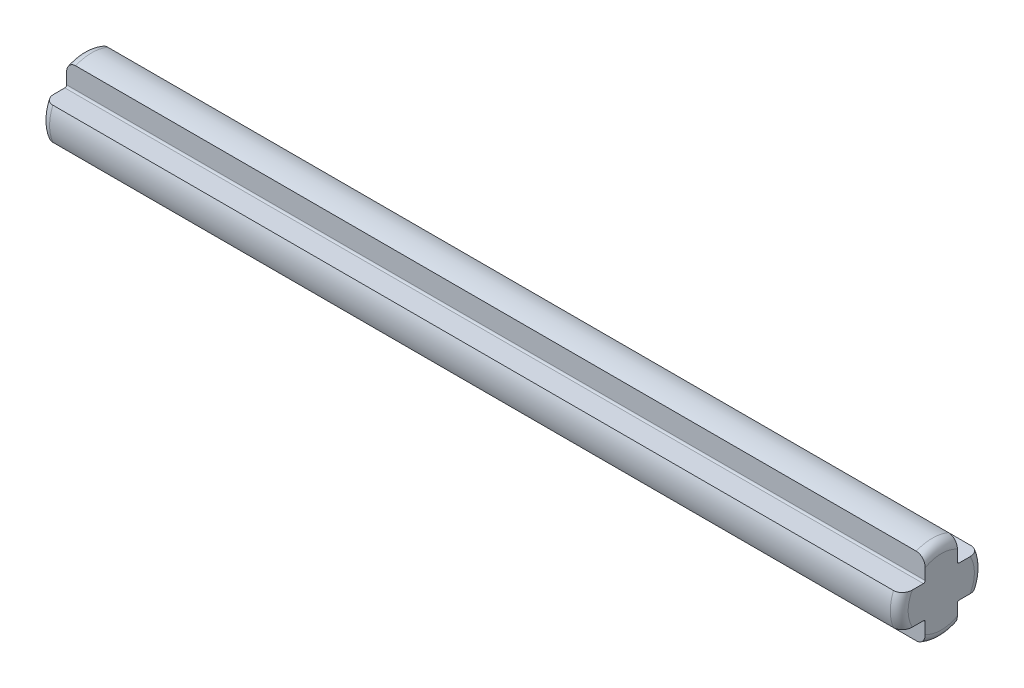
SolidWorks part; units mm, degrees
ref_plane "Alzado" through (0, 0, 0) normal (0, 0, 1) x (1, 0, 0)
ref_plane "Planta" through (0, 0, 0) normal (0, 1, 0) x (1, 0, 0)
ref_plane "Vista lateral" through (0, 0, 0) normal (1, 0, 0) x (0, 0, -1)
sketch "Croquis1" plane through (0, 0, 0) normal (1, 0, 0) x (0, 0, -1)
  line L0 (-3.7919, 0) -> (3.9132, 0) construction
  line L1 (-0.9, 2.1708) -> (-0.9, 1)
  line L2 (-2.1708, 0.9) -> (-1, 0.9)
  line L3 (2.1708, 0.9) -> (1, 0.9)
  line L4 (0.9, 2.1708) -> (0.9, 1)
  line L5 (0, 3.4809) -> (0, -0.8787) construction
  line L6 (0.9, -2.1708) -> (0.9, -1)
  line L7 (2.1708, -0.9) -> (1, -0.9)
  line L8 (-2.1708, -0.9) -> (-1, -0.9)
  line L9 (-0.9, -2.1708) -> (-0.9, -1)
  arc A0 (-2.1708, 0.9) -> (-2.1708, -0.9) centre (0, 0) ccw
  arc A1 (0.9, 2.1708) -> (-0.9, 2.1708) centre (0, 0) ccw
  arc A2 (-1, 0.9) -> (-0.9, 1) centre (-1, 1) ccw
  arc A3 (1, 0.9) -> (0.9, 1) centre (1, 1) cw
  arc A4 (2.1708, 0.9) -> (2.1708, -0.9) centre (0, 0) cw
  arc A5 (1, -0.9) -> (0.9, -1) centre (1, -1) ccw
  arc A6 (-1, -0.9) -> (-0.9, -1) centre (-1, -1) cw
  arc A7 (0.9, -2.1708) -> (-0.9, -2.1708) centre (0, 0) cw
  dimension "D1" = 2.35
  dimension "D4" = 0.1
  dimension "D2" = 1.8
  dimension "D3" = 1.8
extrude "Extruir1" add sketch "Croquis1" along normal mid plane 48
fillet "Redondeo1" radius 0.5 8 edges at (24, 2.35, 0) (24, 0, -2.35) (24, -2.35, 0) (24, 0, 2.35) (-24, -2.35, 0) (-24, 0, -2.35) (-24, 2.35, 0) (-24, 0, 2.35)
